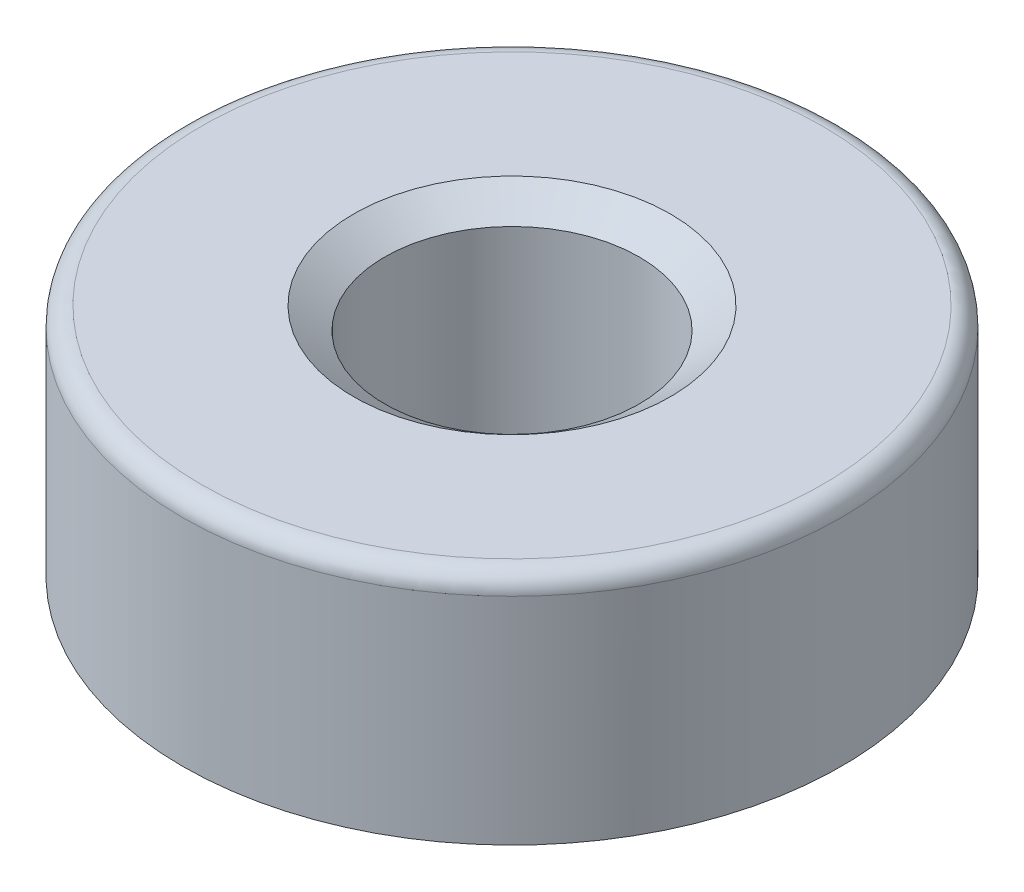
SolidWorks part; units mm, degrees
ref_plane "Plane1" through (0, 0, 0) normal (0, 0, 1) x (1, 0, 0)
ref_plane "Plane2" through (0, 0, 0) normal (0, 1, 0) x (1, 0, 0)
ref_plane "Plane3" through (0, 0, 0) normal (1, 0, 0) x (0, 0, -1)
sketch "BodySke" plane through (0, 0, 0) normal (0, 0, 1) x (1, 0, 0)
  line L0 (4.0005, 0) -> (4.8675, 0)
  line L1 (6.604, 0) -> (6.604, 4.318)
  line L2 (6.223, 4.699) -> (2.5527, 4.699)
  line L3 (2.5527, 4.699) -> (2.5527, -1.2192)
  line L4 (2.5527, -1.2192) -> (4.0005, -1.2192)
  line L5 (4.0005, -1.2192) -> (4.0005, 0)
  line L6 (6.604, 0) -> (5.737, -0.6096)
  line L7 (1.016, 1.27) -> (3.6522, 1.27) construction
  line L8 (5.737, -0.6096) -> (4.8675, 0)
  line L9 (0, 0) -> (0, 15.24) construction
  arc A0 (6.604, 4.318) -> (6.223, 4.699) centre (6.223, 4.318) ccw
  point P14 (6.604, 4.699)
  dimension "D1" = 0.381
  dimension "E_dia" = 13.208
  dimension "C_dia" = 8.001
  dimension "A_ht" = 1.2192
  dimension "T_ht" = 4.699
  dimension "Thread_min" = 5.1054
  dimension "Advance" = 1.27
  dimension "Lug_minor_dia" = 9.7349
  dimension "Lug_tip_dia" = 11.4741
  dimension "Lug_ht" = 0.6096
revolve "Body" add sketch "BodySke"
revolve "EndChamfer" cut sketch "EndChamferSke" angle 360 about L0
sketch "EndChamferSke" plane through (0, 0, 0) normal (0, 0, 1) x (1, 0, 0)
  line L0 (0, -2.54) -> (0, 7.62) construction
  line L1 (0, 0) -> (0, 15.24) construction
  line L2 (3.175, -1.4732) -> (3.175, -0.9652)
  line L3 (3.175, -0.9652) -> (2.5527, -0.5296)
  line L4 (2.5527, -0.5296) -> (2.5527, -1.4732)
  line L5 (2.5527, -1.4732) -> (3.175, -1.4732)
  line L6 (3.175, 4.699) -> (2.5527, 4.2634)
  line L8 (2.5527, 4.2634) -> (2.5527, 4.699)
  line L9 (3.175, 4.699) -> (2.5527, 4.699)
  line L10 (2.5527, 4.699) -> (-2.5527, 4.699) construction
  line L11 (-4.0005, -1.2192) -> (4.0005, -1.2192) construction
  dimension "D1" = 0.254
  dimension "Thread_nominal" = 6.35
  dimension "D2" = 34.99
  dimension "Thread_min" = 5.1054
  dimension "Inset" = 0.254
ref_plane "Plane4" through (0, -0.5486, 0) normal (0, 1, 0) x (-1, 0, 0)
sketch "ThdSchSke" plane through (0, 0, 0) normal (0, 0, 1) x (1, 0, 0)
  line L0 (0, -5.08) -> (0, 7.62) construction
  line L1 (0, 0) -> (0, 15.24) construction
  line L2 (0, -0.9652) -> (3.175, -0.9652) construction
  line L4 (3.175, -0.9652) -> (2.5527, -0.5295)
  line L6 (3.175, -0.9652) -> (2.5527, -1.4009)
  line L7 (2.5527, -0.5295) -> (2.5527, -1.4009)
  line L8 (3.175, -0.9652) -> (-3.175, -0.9652) construction
  dimension "Vee_angle" = 70
  dimension "Thread_nominal" = 6.35
  dimension "Thread_min" = 5.1054
revolve "ThreadSchematic" [suppressed] cut sketch "ThdSchSke" angle 360 about L0
pattern_linear "ThdSchPat" [suppressed]
sketch "LugGapSke" plane through (0, 0, 0) normal (0, 1, 0) x (1, 0, 0)
  line L0 (-0.9258, -4.7786) -> (-1.8304, -6.3453)
  line L1 (4.6013, -1.5875) -> (6.4104, -1.5875)
  line L2 (0, 0) -> (-3.8626, -6.6901) construction
  line L3 (0, 0) -> (7.366, 0) construction
  arc A0 (-1.8304, -6.3453) -> (6.4104, -1.5875) centre (0, 0) ccw
  arc A1 (-0.9258, -4.7786) -> (4.6013, -1.5875) centre (0, 0) ccw
  circle A2 centre (0, 0) radius 4.8675 construction
  circle A3 centre (0, 0) radius 6.604 construction
  dimension "Depth" = 120
  dimension "Lug_wid1" = 3.175
  dimension "Lug_wid2" = 3.175
extrude "LugGap" cut sketch "LugGapSke" against normal blind 6.35
pattern_circular "LugGapPat" count 3 every 120 about axis through (0, 0, 0) along (0, 1, 0) of "LugGap"
equation "' \"A_ht@BodySke\" = 0.048"
equation "' \"C_dia@BodySke\" = 0.315"
equation "' \"E_dia@BodySke\" = 0.52"
equation "' \"T_ht@BodySke\" = 0.185"
equation "' \"Advance@BodySke\" = 0.05"
equation "' \"Thread_min@BodySke\" = 0.201"
equation "' \"Thread_nominal@ThreadCosmetic\" = 0.25"
equation "\"Lug_ht@BodySke\" = \"A_ht@BodySke\" / 2"
equation "\"Lug_tip_dia@BodySke\" = \"C_dia@BodySke\" + (\"E_dia@BodySke\" - \"C_dia@BodySke\" ) * 0.667"
equation "\"Lug_minor_dia@BodySke\" = \"C_dia@BodySke\" + (\"E_dia@BodySke\" - \"C_dia@BodySke\" ) * 0.333"
equation "\"Lug_wid1@LugGapSke\" = \"Thread_nominal@ThreadCosmetic\" * 0.5"
equation "\"Lug_wid2@LugGapSke\" = \"Lug_wid1@LugGapSke\""
equation "\"Thread_nominal@EndChamferSke\" = \"Thread_nominal@ThreadCosmetic\""
equation "\"Thread_min@EndChamferSke\" = \"Thread_min@BodySke\""
equation "\"D2@EndChamferSke\" = \"Vee_angle@ThdSchSke\" / 2 - 0.01"
equation "\"Thread_nominal@ThdSchSke\" = \"Thread_nominal@ThreadCosmetic\""
equation "\"Thread_min@ThdSchSke\" = \"Thread_min@BodySke\""
equation "\"Num_threads@ThdSchPat\" = int(  ( \"A_ht@BodySke\" + \"T_ht@BodySke\" - \"Inset@EndChamferSke\" ) / \"Advance@BodySke\" + 0.999 )  + 1"
equation "\"Advance@ThdSchPat\" = (  \"A_ht@BodySke\" + \"T_ht@BodySke\" - \"Inset@EndChamferSke\"  ) /  (\"Num_threads@ThdSchPat\" - 1) 'relax it"
